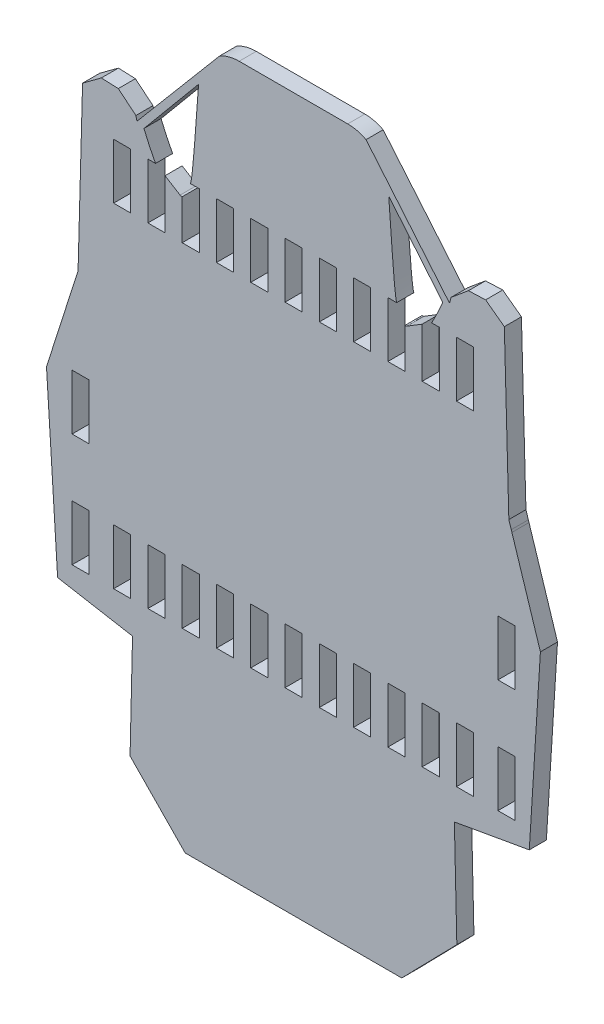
SolidWorks part; units mm, degrees
ref_plane "Alzado" through (0, 0, 0) normal (0, 0, 1) x (1, 0, 0)
ref_plane "Planta" through (0, 0, 0) normal (0, 1, 0) x (1, 0, 0)
ref_plane "Vista lateral" through (0, 0, 0) normal (1, 0, 0) x (0, 0, -1)
sketch "Croquis2" plane through (0, 0, 0) normal (0, 0, 1) x (1, 0, 0)
sketch_block_instance "F1 CAR CUT corte-1"
sketch_block "Bloque1"
extrude "Saliente-Extruir1" add sketch "Croquis2" along normal blind 3
delete or keep bodies "Sólido-Eliminar/Conservar 27" type delete bodies bodies 109 105 110 106 111 107
delete or keep bodies "Sólido-Eliminar/Conservar 28" type delete bodies bodies 112 104 113 114
delete or keep bodies "Sólido-Eliminar/Conservar 29" type delete bodies bodies 108 102 101
